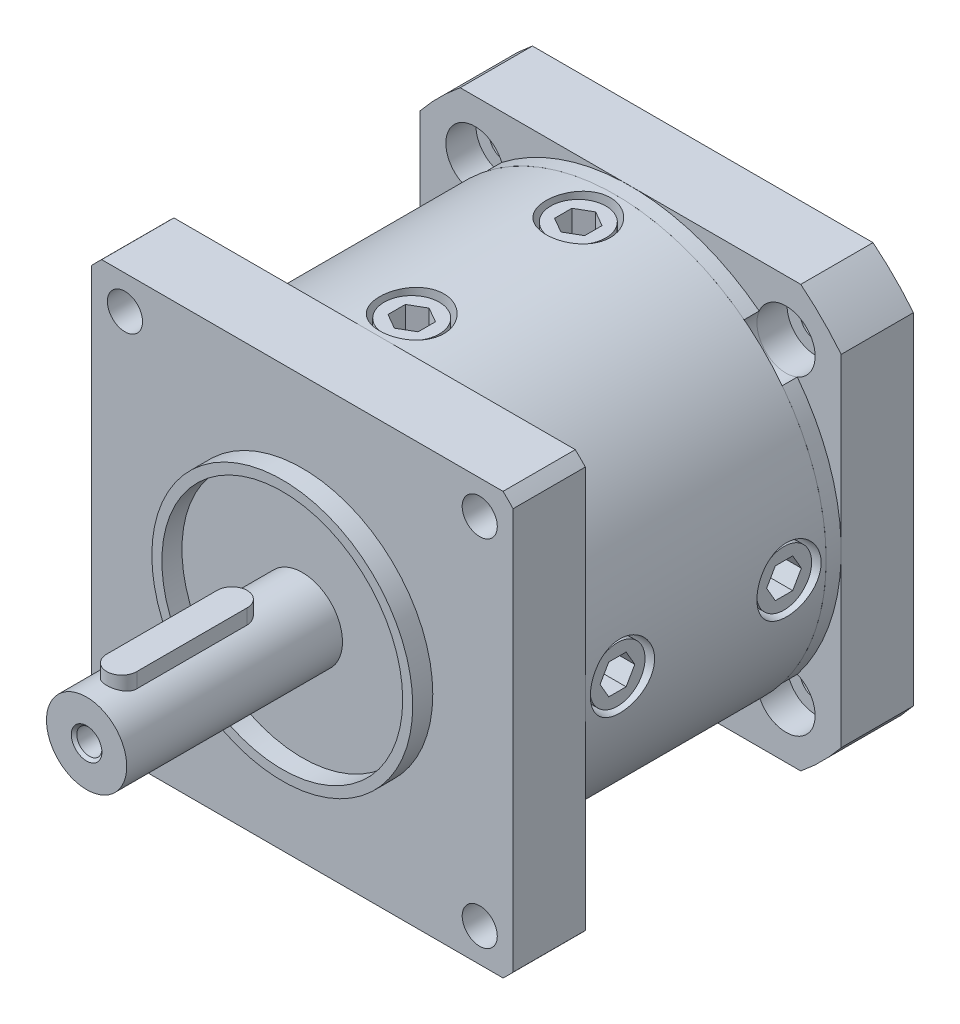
SolidWorks part; units mm, degrees
ref_plane "前视基准面" through (0, 0, 0) normal (0, 0, 1) x (1, 0, 0)
ref_plane "上视基准面" through (0, 0, 0) normal (0, 1, 0) x (1, 0, 0)
ref_plane "右视基准面" through (0, 0, 0) normal (1, 0, 0) x (0, 0, -1)
sketch "草图1" plane through (0, 0, 0) normal (0, 0, 1) x (1, 0, 0)
  line L1 (-20, -21) -> (20, -21)
  line L2 (-21, -20) -> (-21, 20)
  line L3 (-20, 21) -> (20, 21)
  line L4 (21, -20) -> (21, 20)
  line L5 (0, 21) -> (0, -21) construction
  line L6 (-21, 0) -> (21, 0) construction
  arc A0 (-20, 21) -> (-21, 20) centre (0, 0) ccw
  arc A1 (21, 20) -> (20, 21) centre (0, 0) ccw
  arc A2 (20, -21) -> (21, -20) centre (0, 0) ccw
  arc A3 (-21, -20) -> (-20, -21) centre (0, 0) ccw
  arc A4 (-21, -13.5647) -> (-21, 13.5647) centre (0, 0) ccw construction
  circle A5 centre (-17.6777, 17.6777) radius 1.75
  circle A6 centre (17.6777, 17.6777) radius 1.75
  circle A7 centre (17.6777, -17.6777) radius 1.75
  circle A8 centre (-17.6777, -17.6777) radius 1.75
  point P0 (0, 0)
  point P25 (0, 0)
  dimension "D3" = 3.5
  dimension "D4" = 4
extrude "凸台-拉伸2" add sketch "草图1" along normal blind 7.2
sketch "草图15" plane through (0, 0, 0) normal (0, 0, -1) x (-1, 0, 0)
  circle A0 centre (0, 0) radius 21
  dimension "D1" = 42
extrude "凸台-拉伸8" add sketch "草图15" along normal blind 24
sketch "草图17" plane through (0, 0, 7.2) normal (0, 0, 1) x (1, 0, 0)
  circle A0 centre (0, 0) radius 13
  circle A1 centre (0, 0) radius 12
  dimension "D1" = 26
  dimension "D2" = 24
extrude "凸台-拉伸9" add sketch "草图17" along normal blind 2
sketch "草图18" plane through (0, 0, 7.2) normal (0, 0, 1) x (1, 0, 0)
  circle A0 centre (0, 0) radius 4
  dimension "D1" = 8
extrude "凸台-拉伸10" add sketch "草图18" along normal blind 21.5
hole_wizard "M3 螺纹孔1" positions "草图22" profile "草图23" tap size "M3" standard "GB"
sketch "草图22" plane through (0, 0, 28.7) normal (0, 0, 1) x (1, 0, 0)
  point P0 (0, 0)
sketch "草图23" plane through (0, 0, 28.7) normal (1, 0, 0) x (0, -1, 0)
  line L0 (0, 0) -> (0, 11.7511)
  line L1 (0, 11.7511) -> (1.25, 11)
  line L2 (1.25, 11) -> (1.25, 0.275)
  line L3 (1.25, 0.275) -> (1.525, 0)
  line L5 (1.525, 0) -> (0, 0)
  line L6 (-1.25, 0.275) -> (-1.525, 0) construction
  line L10 (0, 11.7511) -> (-1.25, 11) construction
  line L11 (0, -6.35) -> (0, 107.95) construction
  dimension "螺纹孔钻头直径" = 2.5
  dimension "螺纹孔钻头深度" = 11
  dimension "近端锥形沉头孔直径" = 3.05
  dimension "近端锥形沉头孔角度" = 90
  dimension "导头角度" = 118
sketch "草图24" plane through (0, 0, 0) normal (0, 1, 0) x (1, 0, 0)
  line L0 (0, -14.2) -> (0, -25.2) construction
  line L2 (1.5, -14.2) -> (1.5, -25.2)
  line L3 (-1.5, -14.2) -> (-1.5, -25.2)
  line L4 (-4, -28.7) -> (4, -28.7) construction
  arc A0 (1.5, -14.2) -> (-1.5, -14.2) centre (0, -14.2) ccw
  arc A1 (-1.5, -25.2) -> (1.5, -25.2) centre (0, -25.2) ccw
  point P5 (0, -19.7)
  dimension "D1" = 3
  dimension "D2" = 11
  dimension "D3" = 3.5
extrude "凸台-拉伸11" add sketch "草图24" along normal blind 3 from offset 2.2
sketch "草图25" plane through (0, 0, -24) normal (0, 0, -1) x (-1, 0, 0)
  circle A0 centre (0, 0) radius 21
  dimension "D1" = 42
extrude "凸台-拉伸12" add sketch "草图25" along normal blind 1.5 separate body
sketch "草图26" plane through (0, 0, -25.5) normal (0, 0, -1) x (-1, 0, 0)
  line L1 (-16.9706, 21) -> (16.9706, 21)
  line L2 (-21, 16.9706) -> (-21, -16.9706)
  line L3 (-16.9706, -21) -> (16.9706, -21)
  line L4 (21, 16.9706) -> (21, -16.9706)
  line L5 (0, -21) -> (0, 21) construction
  line L6 (-21, 0) -> (21, 0) construction
  line L7 (-15.5, 15.5) -> (15.5, 15.5) construction
  line L8 (-15.5, 15.5) -> (-15.5, -15.5) construction
  line L9 (-15.5, -15.5) -> (15.5, -15.5) construction
  line L10 (15.5, 15.5) -> (15.5, -15.5) construction
  line L11 (0, -15.5) -> (0, 15.5) construction
  line L12 (-15.5, 0) -> (15.5, 0) construction
  arc A0 (16.9706, -21) -> (21, -16.9706) centre (0, 0) ccw
  arc A1 (-21, -16.9706) -> (-16.9706, -21) centre (0, 0) ccw
  arc A2 (-16.9706, 21) -> (-21, 16.9706) centre (0, 0) ccw
  arc A3 (21, 16.9706) -> (16.9706, 21) centre (0, 0) ccw
  circle A4 centre (-15.5, 15.5) radius 1.6
  circle A5 centre (15.5, 15.5) radius 1.6
  circle A6 centre (15.5, -15.5) radius 1.6
  circle A7 centre (-15.5, -15.5) radius 1.6
  point P0 (0, 0)
  point P22 (0, 0)
  dimension "D3" = 54
  dimension "D4" = 3.2
  dimension "D1" = 31
  dimension "D2" = 31
  dimension "D5" = 4
extrude "凸台-拉伸13" add sketch "草图26" along normal blind 7.2 separate body
sketch "草图27" plane through (0, 0, -32.7) normal (0, 0, -1) x (-1, 0, 0)
  circle A0 centre (0, 0) radius 11
  dimension "D1" = 22
extrude "切除-拉伸1" cut sketch "草图27" against normal blind 3
sketch "草图28" plane through (0, 0, -29.7) normal (0, 0, -1) x (-1, 0, 0)
  circle A0 centre (0, 0) radius 10
  dimension "D1" = 20
extrude "切除-拉伸2" cut sketch "草图28" against normal blind 10
sketch "草图29" plane through (0, 0, -19.7) normal (0, 0, -1) x (-1, 0, 0)
  circle A0 centre (0, 0) radius 7.5
  dimension "D1" = 15
extrude "凸台-拉伸14" add sketch "草图29" along normal blind 8 separate body
sketch "草图30" plane through (0, 0, -27.7) normal (0, 0, -1) x (-1, 0, 0)
  line L1 (-1.5, 2) -> (1.5, 2)
  arc A0 (-1.5, 2) -> (1.5, 2) centre (0, 0) ccw
  point P8 (0, 2)
  dimension "D1" = 5
extrude "切除-拉伸3" cut sketch "草图30" against normal blind 7
hole_wizard "M3 螺纹孔2" positions "草图32" profile "草图33" tap size "M3" standard "GB"
sketch "草图32" plane through (0, 2, 0) normal (0, -1, 0) x (-1, 0, 0)
  point P0 (0, 25.2557)
sketch "草图33" plane through (0, 2, -25.2557) normal (1, 0, 0) x (0, 0, -1)
  line L0 (0, 0) -> (0, 8.2511)
  line L1 (0, 8.2511) -> (1.25, 7.5)
  line L2 (1.25, 7.5) -> (1.25, 0)
  line L5 (1.25, 0) -> (0, 0)
  line L10 (0, 8.2511) -> (-1.25, 7.5) construction
  line L11 (0, -6.35) -> (0, 107.95) construction
  dimension "螺纹孔钻头直径" = 2.5
  dimension "螺纹孔钻头深度" = 7.5
  dimension "导头角度" = 118
sketch "草图37" plane through (0, 0, -24) normal (0, 0, 1) x (1, 0, 0)
  circle A0 centre (15.5, 15.5) radius 2.9
  circle A1 centre (15.5, -15.5) radius 2.9
  circle A2 centre (-15.5, -15.5) radius 2.9
  circle A3 centre (-15.5, 15.5) radius 2.9
  point P11 (0, 0)
  dimension "D1" = 5.8
  dimension "D2" = 4
extrude "切除-拉伸4" cut sketch "草图37" against normal blind 4.5
sketch "草图38" plane through (21, 0, 0) normal (1, 0, 0) x (0, 0, -1)
  line L4 (0, -20) -> (0, 0) construction
  line L7 (24, -21) -> (24, 21) construction
  circle A0 centre (3.7, 0) radius 3.2
  circle A1 centre (20.3, 0) radius 3.2
  dimension "D1" = 0.5
  dimension "D2" = 6.4
  dimension "D3" = 0.5
  dimension "D4" = 6.4
extrude "切除-拉伸5" cut sketch "草图38" against normal blind 3.5
sketch "草图39" plane through (17.5, 0, 0) normal (1, 0, 0) x (0, 0, -1)
  circle A0 centre (3.7, 0) radius 2.75
  circle A1 centre (20.3, 0) radius 2.75
  dimension "D1" = 5.5
  dimension "D2" = 5.5
extrude "凸台-拉伸15" add sketch "草图39" along normal blind 3
sketch "草图40" plane through (20.5, 0, 0) normal (1, 0, 0) x (0, 0, -1)
  line L1 (5.4321, 0) -> (4.566, 1.5)
  line L2 (4.566, 1.5) -> (2.834, 1.5)
  line L3 (2.834, 1.5) -> (1.9679, 0)
  line L4 (1.9679, 0) -> (2.834, -1.5)
  line L5 (2.834, -1.5) -> (4.566, -1.5)
  line L6 (4.566, -1.5) -> (5.4321, 0)
  line L7 (22.0321, 0) -> (21.166, 1.5)
  line L8 (21.166, 1.5) -> (19.434, 1.5)
  line L9 (19.434, 1.5) -> (18.5679, 0)
  line L10 (18.5679, 0) -> (19.434, -1.5)
  line L11 (19.434, -1.5) -> (21.166, -1.5)
  line L12 (21.166, -1.5) -> (22.0321, 0)
  circle A0 centre (3.7, 0) radius 1.5 construction
  circle A1 centre (20.3, 0) radius 1.5 construction
  dimension "D1" = 3
  dimension "D2" = 3
extrude "切除-拉伸6" cut sketch "草图40" against normal blind 3
pattern_circular "阵列(圆周)1" count 4 every 90 about axis through (0, 0, 0) along (0, 0, 1) of "切除-拉伸6", "凸台-拉伸15", "切除-拉伸5"
